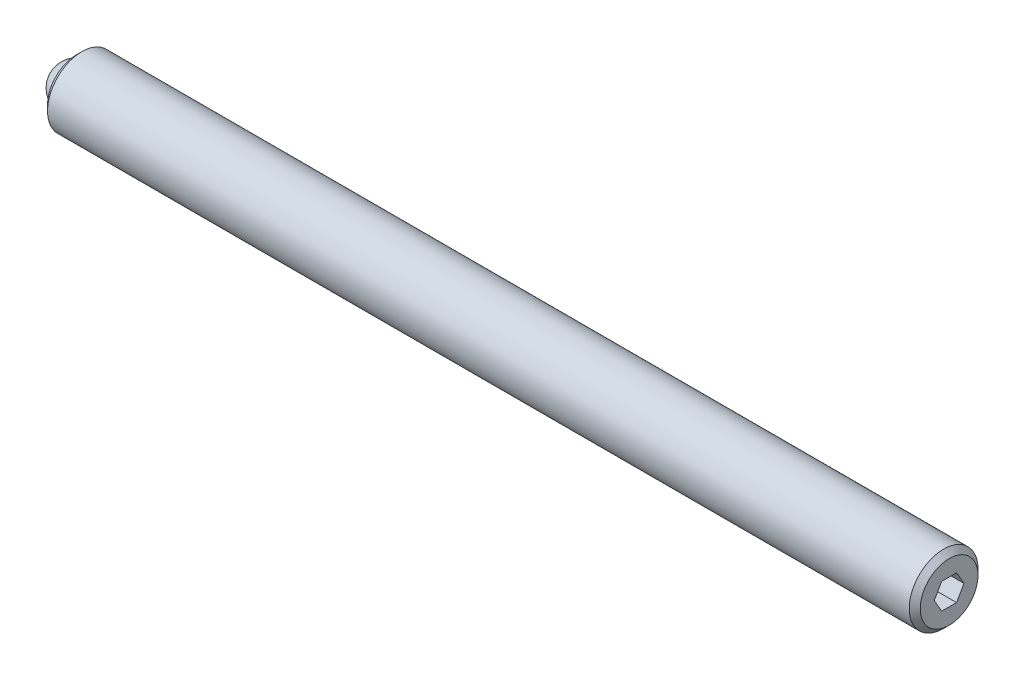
SolidWorks part; units mm, degrees
ref_plane "Front Plane" through (0, 0, 0) normal (0, 0, 1) x (1, 0, 0)
ref_plane "Top Plane" through (0, 0, 0) normal (0, 1, 0) x (1, 0, 0)
ref_plane "Right Plane" through (0, 0, 0) normal (1, 0, 0) x (0, 0, -1)
sketch "Sketch2" plane through (0, 0, 0) normal (1, 0, 0) x (0, 0, -1)
  circle A0 centre (0, 0) radius 3.175
  dimension "D1" = 6.35
extrude "Boss-Extrude1" add sketch "Sketch2" along normal blind 80.5656
sketch "Sketch3" plane through (0, 0, 0) normal (-1, 0, 0) x (0, 0, 1)
  circle A0 centre (0, 0) radius 1.9812
  dimension "D1" = 3.9624
chamfer "Chamfer1" distance 0.508 angle 45 1 edges at (0, 0, -3.175)
chamfer "Chamfer2" distance 0.508 angle 45 1 edges at (80.5656, 0, -3.175)
sketch "Sketch4" plane through (80.5656, 0, 0) normal (1, 0, 0) x (0, 0, -1)
  line L1 (1.3748, 0) -> (0.6874, 1.1906)
  line L2 (0.6874, 1.1906) -> (-0.6874, 1.1906)
  line L3 (-0.6874, 1.1906) -> (-1.3748, 0)
  line L4 (-1.3748, 0) -> (-0.6874, -1.1906)
  line L5 (-0.6874, -1.1906) -> (0.6874, -1.1906)
  line L6 (0.6874, -1.1906) -> (1.3748, 0)
  circle A0 centre (0, 0) radius 1.1906 construction
  dimension "D1" = 2.3813
extrude "Cut-Extrude2" cut sketch "Sketch4" against normal blind 2.286
extrude "Cut-Extrude3" cut sketch "Sketch3" against normal blind 1.9844
sketch "Sketch5" plane through (0, 0, 0) normal (-1, 0, 0) x (0, 0, 1)
  line L0 (0, 0) -> (0, -1.9844)
  line L1 (0, 0) -> (0, 1.9844)
  arc A0 (0, 1.9844) -> (0, -1.9844) centre (0, 0) ccw
  dimension "D1" = 1.9844
revolve "Revolve1" add sketch "Sketch5" angle 360 about L1
